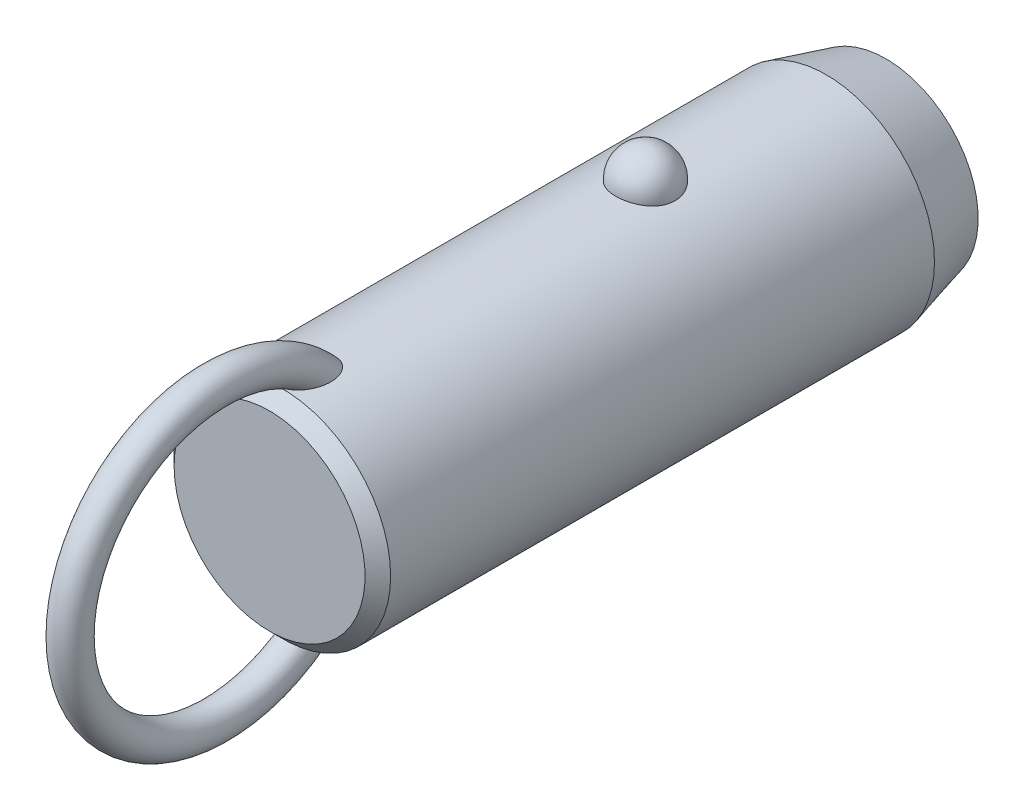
SolidWorks part; units mm, degrees
ref_plane "Front Plane" through (0, 0, 0) normal (0, 0, 1) x (1, 0, 0)
ref_plane "Top Plane" through (0, 0, 0) normal (0, 1, 0) x (1, 0, 0)
ref_plane "Right Plane" through (0, 0, 0) normal (1, 0, 0) x (0, 0, -1)
sketch "Sketch2" plane through (0, 0, 0) normal (0, 0, 1) x (1, 0, 0)
  circle A0 centre (0, 0) radius 12.7
  point P3 (0, 12.7)
  dimension "D1" = 25.4
extrude "Boss-Extrude1" add sketch "Sketch2" along normal blind 27.9
sketch "Sketch3" plane through (0, 0, 0) normal (0, 0, -1) x (-1, 0, 0)
  circle A0 centre (0, 0) radius 12.7
  dimension "D1" = 25.4
extrude "Boss-Extrude2" add sketch "Sketch3" along normal blind 31.7
chamfer "Chamfer1" distance 7 angle 15 1 edges at (-12.7, 0, -31.7)
sketch "Sketch12" plane through (0, 0, 0) normal (1, 0, 0) x (0, 0, -1)
  line L0 (-27.9, 12.7) -> (-27.9, -12.7) construction
  point P0 (-27.9, 0)
sketch "Sketch13" plane through (0, 0, 0) normal (1, 0, 0) x (0, 0, -1)
  circle A0 centre (-46.95, 0) radius 19.05
  point P2 (-27.9, 0)
  dimension "D1" = 38.1
sketch "Sketch14" plane through (0, 0, 0) normal (0, 1, 0) x (1, 0, 0)
  circle A0 centre (0, -29.9) radius 2
  point P2 (0, -27.9)
  dimension "D1" = 4
sweep "Sweep1" add profiles "Sketch14" path "Sketch13"
sketch "Sketch15" plane through (0, 0, 27.9) normal (0, 0, 1) x (1, 0, 0)
  circle A0 centre (0, 0) radius 12.7
  dimension "D1" = 25.4
extrude "Boss-Extrude3" add sketch "Sketch15" along normal blind 12.7
chamfer "Chamfer2" distance 1.5 angle 45 1 edges at (12.7, 0, 40.6)
sketch "Sketch18" plane through (0, 0, 0) normal (1, 0, 0) x (0, 0, -1)
  line L0 (24.7, 12.7) -> (-32.751, 12.7) construction
  line L1 (3.5, 16.2) -> (3.5, 9.2)
  line L2 (-32.751, -12.7) -> (24.7, -12.7) construction
  arc A0 (3.5, 16.2) -> (3.5, 9.2) centre (3.5, 12.7) ccw
  point P4 (0, 12.7)
  dimension "D1" = 28.9
revolve "Revolve1" add sketch "Sketch18" angle 360 about L1
